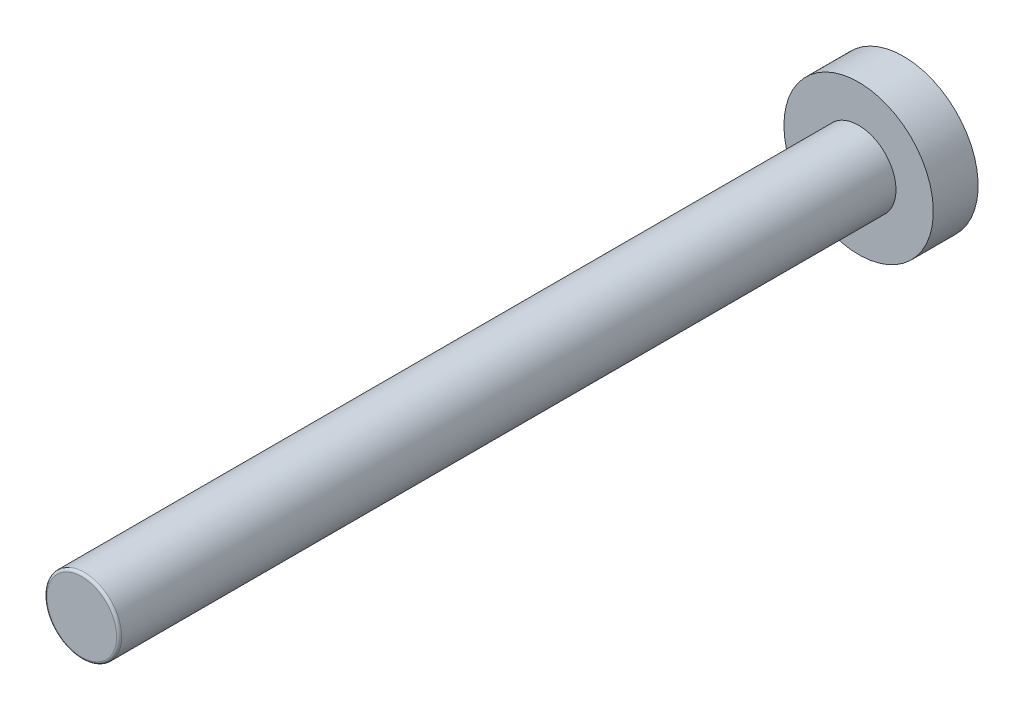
SolidWorks part; units mm, degrees
ref_plane "Alzado" through (0, 0, 0) normal (0, 0, 1) x (1, 0, 0)
ref_plane "Planta" through (0, 0, 0) normal (0, 1, 0) x (1, 0, 0)
ref_plane "Vista lateral" through (0, 0, 0) normal (1, 0, 0) x (0, 0, -1)
sketch "Croquis1" plane through (0, 0, 0) normal (0, 1, 0) x (1, 0, 0)
  line L0 (2.3297, -0.3406) -> (0, -0.3406)
  line L1 (0, -0.3406) -> (0, -55.3406)
  line L2 (0, -55.3406) -> (2.3297, -55.3406)
  line L3 (2.5, -55.1703) -> (2.5, -0.5108)
  line L4 (0, 0.0021) -> (0, -55.3427) construction
  arc A0 (2.3297, -55.3406) -> (2.5, -55.1703) centre (2.3297, -55.1703) ccw
  arc A1 (2.5, -0.5108) -> (2.3297, -0.3406) centre (2.3297, -0.5108) ccw
  dimension "D1" = 55
  dimension "D2" = 2.5
revolve "Revolución1" add sketch "Croquis1" angle 360 about L4
sketch "Croquis2" plane through (0, 0, 0.3406) normal (0, 0, -1) x (-1, 0, 0)
  circle A0 centre (0, 0) radius 5
  dimension "D1" = 10
extrude "Saliente-Extruir1" add sketch "Croquis2" against normal blind 3
